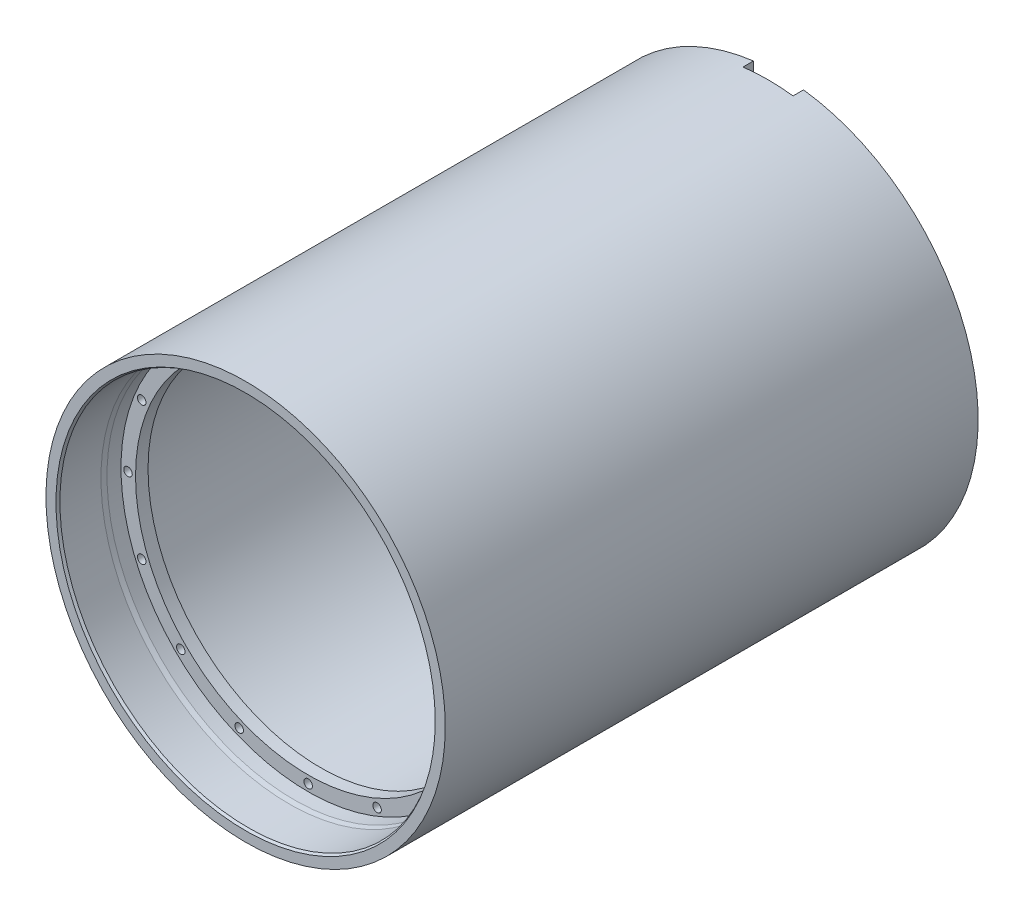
SolidWorks part; units mm, degrees
ref_plane "Front Plane" through (0, 0, 0) normal (0, 0, 1) x (1, 0, 0)
ref_plane "Top Plane" through (0, 0, 0) normal (0, 1, 0) x (1, 0, 0)
ref_plane "Right Plane" through (0, 0, 0) normal (1, 0, 0) x (0, 0, -1)
sketch "Sketch1" plane through (0, 0, 0) normal (0, 0, 1) x (1, 0, 0)
  circle A0 centre (0, 0) radius 101.346
  circle A1 centre (0, 0) radius 94.996
  dimension "D1" = 202.692
  dimension "D2" = 189.992
extrude "Extrude1" add sketch "Sketch1" along normal blind 270.51
ref_plane "fwd_rib_plane" through (0, 0, 38.1) normal (0, 0, 1) x (1, 0, 0)
ref_plane "aft_rib_plane" through (0, 0, 238.76) normal (0, 0, 1) x (1, 0, 0)
sketch "Sketch2" plane through (0, 0, 38.1) normal (0, 0, 1) x (1, 0, 0)
  circle A0 centre (0, 0) radius 101.346
  circle A1 centre (0, 0) radius 87.63
  dimension "D1" = 175.26
extrude "fwd_rib" add sketch "Sketch2" along normal blind 6.35
sketch "Sketch3" plane through (0, 0, 0) normal (0, 0, -1) x (-1, 0, 0)
  circle A0 centre (0, 0) radius 95.5294
  dimension "D1" = 191.0588
extrude "fwd_bore_seal" cut sketch "Sketch3" against normal blind 25.908
sketch "Sketch4" plane through (0, 0, 0) normal (0, 0, -1) x (-1, 0, 0)
  circle A0 centre (0, 0) radius 96.0374
  dimension "D1" = 192.0748
extrude "fwd_ortman_bore" cut sketch "Sketch4" against normal blind 6.35
ref_plane "ortman_plane" through (0, 0, 2.032) normal (0, 0, -1) x (-1, 0, 0)
sketch "Sketch5" plane through (0, 0, 2.032) normal (0, 0, -1) x (-1, 0, 0)
  circle A0 centre (0, 0) radius 97.6884
  dimension "D1" = 195.3768
extrude "ortman_groove" cut sketch "Sketch5" against normal blind 3.302
fillet "ortman_fillet" radius 1.651 2 edges at (-97.6884, 0, 2.032) (-97.6884, 0, 5.334)
chamfer "ortman_chamfer" distance 0.508 angle 60 1 edges at (-95.5294, 0, 6.35)
chamfer "fwd_bore_chamfer" distance 0.5334 distance2 2.54 1 edges at (-94.996, 0, 25.908)
sketch "Sketch6" plane through (0, 0, 238.76) normal (0, 0, 1) x (1, 0, 0)
  circle A0 centre (0, 0) radius 87.63
  circle A1 centre (0, 0) radius 101.346
  dimension "D1" = 175.26
extrude "aft_rib" add sketch "Sketch6" against normal blind 6.35
sketch "Sketch7" plane through (0, 0, 270.51) normal (0, 0, 1) x (1, 0, 0)
  circle A0 centre (0, 0) radius 95.5294
  dimension "D1" = 191.0588
extrude "aft_bore_seal" cut sketch "Sketch7" against normal blind 22.098
chamfer "aft_bore_chamfer" distance 0.5334 distance2 2.54 1 edges at (94.996, 0, 248.412)
sketch "Sketch8" plane through (0, 0, 38.1) normal (0, 0, -1) x (-1, 0, 0)
  circle A0 centre (0, 0) radius 91.44 construction
  circle A1 centre (0, 91.44) radius 2.159
  circle A2 centre (64.6578, 64.6578) radius 2.159
  circle A3 centre (91.44, 0) radius 2.159
  circle A4 centre (64.6578, -64.6578) radius 2.159
  circle A5 centre (0, -91.44) radius 2.159
  circle A6 centre (-64.6578, -64.6578) radius 2.159
  circle A7 centre (-91.44, 0) radius 2.159
  circle A8 centre (-64.6578, 64.6578) radius 2.159
  dimension "D1" = 4.318
  dimension "D2" = 182.88
extrude "fwd_bolt_circle" cut sketch "Sketch8" against normal blind 22.098
sketch "Sketch9" plane through (0, 0, 238.76) normal (0, 0, 1) x (1, 0, 0)
  circle A0 centre (0, 0) radius 91.44 construction
  circle A1 centre (0, 91.44) radius 2.159
  circle A2 centre (34.9926, 84.4795) radius 2.159
  circle A3 centre (64.6578, 64.6578) radius 2.159
  circle A4 centre (84.4795, 34.9926) radius 2.159
  circle A5 centre (91.44, 0) radius 2.159
  circle A6 centre (84.4795, -34.9926) radius 2.159
  circle A7 centre (64.6578, -64.6578) radius 2.159
  circle A8 centre (34.9926, -84.4795) radius 2.159
  circle A9 centre (0, -91.44) radius 2.159
  circle A10 centre (-34.9926, -84.4795) radius 2.159
  circle A11 centre (-64.6578, -64.6578) radius 2.159
  circle A12 centre (-84.4795, -34.9926) radius 2.159
  circle A13 centre (-91.44, 0) radius 2.159
  circle A14 centre (-84.4795, 34.9926) radius 2.159
  circle A15 centre (-64.6578, 64.6578) radius 2.159
  circle A16 centre (-34.9926, 84.4795) radius 2.159
  dimension "D1" = 182.88
  dimension "D2" = 4.318
extrude "aft_bolt_circle" cut sketch "Sketch9" against normal blind 22.098
sketch "Sketch10" plane through (0, 0, 0) normal (0, 1, 0) x (1, 0, 0)
  line L0 (0, 0) -> (0, -15.5114) construction
  line L1 (-12.7, 0) -> (12.7, 0)
  line L2 (96.0374, 0) -> (-96.0374, 0) construction
  line L3 (12.7, 0) -> (12.7, -5.334)
  line L4 (12.7, -5.334) -> (-12.7, -5.334)
  line L5 (-12.7, 0) -> (-12.7, -5.334)
  point P9 (0, -5.334)
  dimension "D1" = 12.7
  dimension "D2" = 5.334
extrude "fwd_ortman_notch" cut sketch "Sketch10" against normal through all and the other way through all
chamfer "Chamfer1" distance 1.27 angle 30 1 edges at (95.5294, 0, 270.51)
